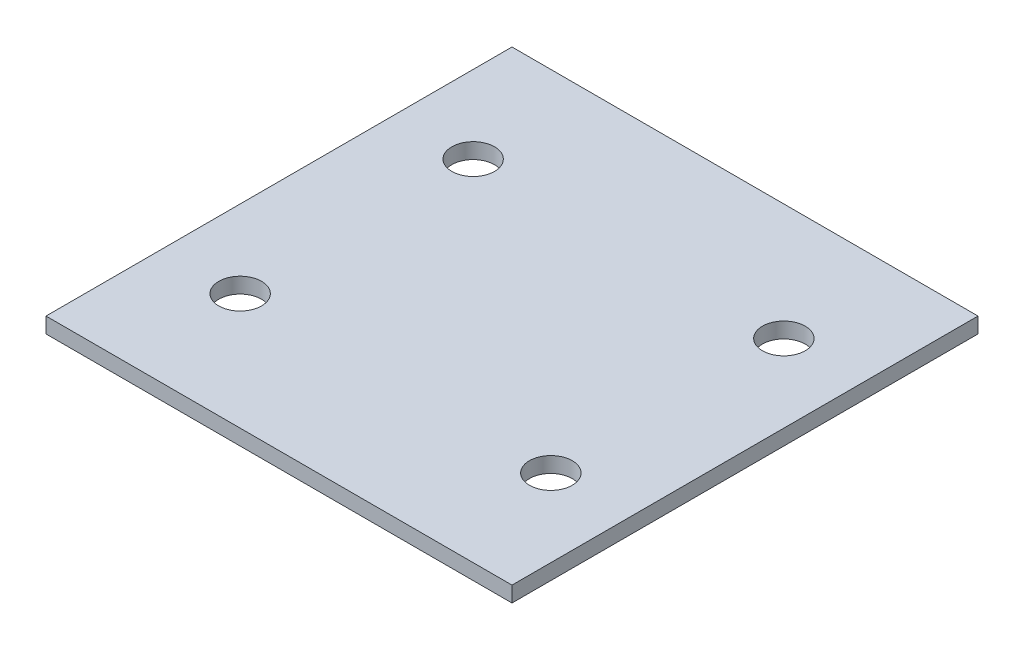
SolidWorks part; units mm, degrees
ref_plane "Спереди" through (0, 0, 0) normal (0, 0, 1) x (1, 0, 0)
ref_plane "Сверху" through (0, 0, 0) normal (0, 1, 0) x (1, 0, 0)
ref_plane "Справа" through (0, 0, 0) normal (1, 0, 0) x (0, 0, -1)
other "Configuration Table"
sketch "Эскиз1" plane through (0, 0, 0) normal (0, 1, 0) x (1, 0, 0)
  line L1 (-60, -60) -> (60, -60)
  line L2 (-60, -60) -> (-60, 60)
  line L3 (-60, 60) -> (60, 60)
  line L4 (60, -60) -> (60, 60)
  circle A0 centre (-40, -30) radius 5.5
  circle A1 centre (-40, 30) radius 5.5
  circle A2 centre (40, -30) radius 5.5
  circle A3 centre (40, 30) radius 5.5
extrude "Пластина 120х120х4, 4 отв. Ø11" add sketch "Эскиз1" along normal blind 4
